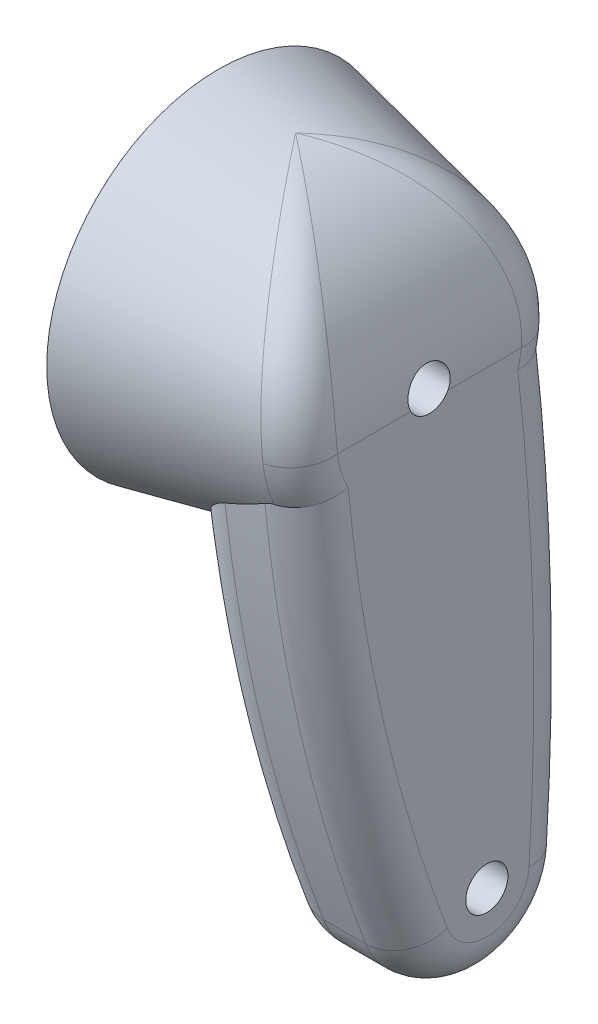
SolidWorks part; units mm, degrees
ref_plane "XY" through (0, 0, 0) normal (0, 0, 1) x (1, 0, 0)
ref_plane "YZ" through (0, 0, 0) normal (0, 1, 0) x (1, 0, 0)
ref_plane "XZ" through (0, 0, 0) normal (1, 0, 0) x (0, 0, -1)
ref_plane "Arm-plane" through (254, 0, 0) normal (1, 0, 0) x (0, 0, -1)
sketch "Sketch4" plane through (254, 0, 0) normal (1, 0, 0) x (0, 0, -1)
  line L0 (40.4939, -84.495) -> (5.9396, 192.7601) construction
  line L3 (272.0816, 0) -> (-272.0816, 0) construction
  arc A0 (81.5087, 202.5456) -> (-70.0871, 187.6243) centre (5.9396, 192.7601) ccw
  arc A1 (-70.0871, 187.6243) -> (-7.0382, -102.4211) centre (943.6027, 256.1009) ccw
  arc A2 (81.5087, 202.5456) -> (91.1962, -87.6443) centre (-1429.8725, 6.8342) cw
  arc A3 (-7.0382, -102.4211) -> (91.1962, -87.6443) centre (40.4939, -84.495) ccw
  dimension "D1" = 76.2
  dimension "D2" = 50.8
  dimension "D5" = 1524
  dimension "D6" = 1016
  dimension "D3" = 279.4
  dimension "D4" = 97.104
extrude "Base-Extrude" add sketch "Sketch4" along normal mid plane 76.2
sketch "Sketch5" plane through (292.1, 0, 0) normal (1, 0, 0) x (0, 0, -1)
  circle A0 centre (5.9396, 192.7601) radius 76.2
extrude "Boss-Extrude1" add sketch "Sketch5" against normal blind 127 draft 12
sketch "Sketch6" plane through (0, 0, 0) normal (0, 0, 1) x (1, 0, 0)
  line L0 (292.1, 268.9601) -> (165.1, 295.9547) construction
  line L1 (211.6238, 286.0658) -> (165.1, 295.9547)
  line L2 (292.1, -102.4211) -> (292.1, 187.6243) construction
  line L3 (292.1, -102.4211) -> (292.1, 186.686)
  arc A0 (292.1, 186.686) -> (211.6238, 286.0658) centre (190.5, 186.686) ccw
  dimension "D1" = 101.6
extrude "Cut-Extrude1" cut sketch "Sketch6" against normal through all and the other way through all flip side to cut
fillet "Fillet12" radius 25.4 8 edges at (292.1, 49.695, -93.5247) (285.7246, 172.6579, 68.965) (281.6797, 231.5058, -74.1134) (274.0844, 244.4459, 55.1608) (292.1, 39.8273, 49.1117) (292.1, -134.7298, -48.0504)
fillet "Fillet8" radius 25.4 4 edges at (215.9, 13.8171, 43.086) (215.9, 30.882, -93.9378) (215.9, -134.7298, -48.0504)
sketch "Sketch7" plane through (165.1, 0, 0) normal (-1, 0, 0) x (0, 0, 1)
  circle A0 centre (-5.9396, 192.7601) radius 12.7
  circle A1 centre (-5.9396, 192.7601) radius 103.1947 construction
  circle A2 centre (-40.4939, -84.495) radius 12.7
  arc A3 (-91.1962, -87.6443) -> (7.0382, -102.4211) centre (-40.4939, -84.495) ccw construction
  dimension "D1" = 25.4
extrude "Cut-Extrude2" cut sketch "Sketch7" against normal through all
